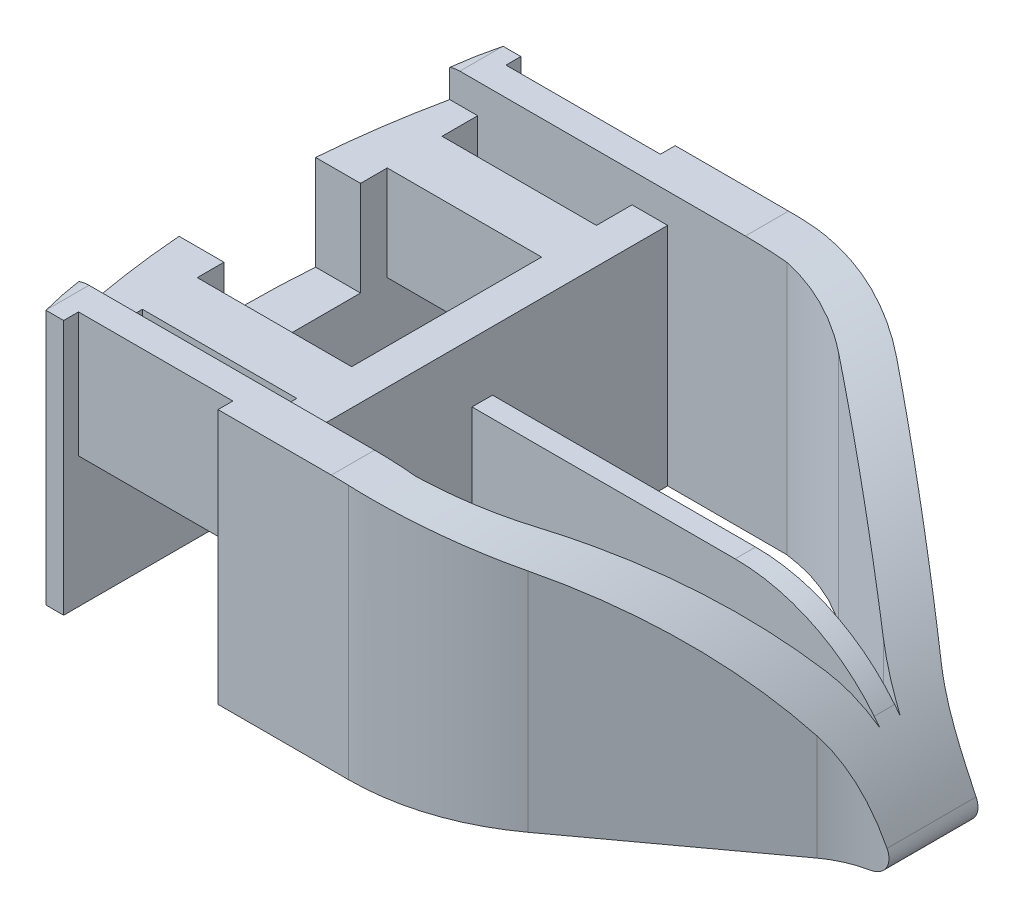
SolidWorks part; units mm, degrees
ref_plane "Plan de face" through (0, 0, 0) normal (0, 0, 1) x (1, 0, 0)
ref_plane "Plan de dessus" through (0, 0, 0) normal (0, 1, 0) x (1, 0, 0)
ref_plane "Plan de droite" through (0, 0, 0) normal (1, 0, 0) x (0, 0, -1)
sketch "Esquisse1" plane through (0, 0, 0) normal (0, 0, 1) x (1, 0, 0)
  line L0 (34, 0) -> (113, 0)
  line L8 (34, 22) -> (8, 22)
  line L9 (53.0917, 43) -> (5, 43)
  line L10 (0, 0) -> (0, 38)
  line L11 (8, 0) -> (8, 22)
  line L12 (8, 0) -> (0, 0)
  line L16 (34, 0) -> (34, 22)
  arc A0 (5, 43) -> (0, 38) centre (5, 38) ccw
  arc A1 (115.6825, 4.3433) -> (53.0917, 43) centre (53.0917, -27) ccw
  arc A2 (113, 0) -> (115.6825, 4.3433) centre (113, 3) ccw
  dimension "D4" = 3
  dimension "D5" = 70
  dimension "D7" = 5
  dimension "D1" = 116
  dimension "D2" = 8
  dimension "D3" = 26
  dimension "D6" = 43
  dimension "D8" = 22
extrude "Extrusion1" add sketch "Esquisse1" along normal mid plane 77
sketch "Esquisse2" plane through (0, 43, 0) normal (0, 1, 0) x (-1, 0, 0)
  line L1 (-5.025, -38.5) -> (0, -38.5)
  line L3 (0, -38.5) -> (0, 0)
  arc A0 (-5.025, -38.5) -> (0, 0) centre (-150, 0) ccw
  dimension "D1" = 150
extrude "Enlèv. mat.-Extru.1" cut sketch "Esquisse2" against normal through all
sketch "Esquisse3" plane through (0, 43, 0) normal (0, 1, 0) x (-1, 0, 0)
  line L0 (-115.6825, 38.5) -> (-115.6825, -38.5) construction
  line L1 (-115.6825, -38.5) -> (-53.0917, -38.5) construction
  line L2 (-116, 38.5) -> (-116, -38.5) construction
  line L3 (-53.0917, 38.5) -> (-115.6825, 38.5) construction
  line L4 (-78.7415, -31.0656) -> (-106.8443, -10.4931)
  line L5 (-56, -38.5) -> (-116, -38.5)
  line L6 (-116, -7.5) -> (-116, -38.5)
  line L7 (-116, 38.5) -> (-116, -38.5) construction
  arc A0 (-106.8443, -10.4931) -> (-116, -7.5) centre (-116, -23) ccw
  arc A1 (-78.7415, -31.0656) -> (-56, -38.5) centre (-56, 0) ccw
  point P4 (-115.6825, 0)
  dimension "D1" = 7.5
  dimension "D2" = 60
extrude "Enlèv. mat.-Extru.2" cut sketch "Esquisse3" against normal through all
mirror "Symétrie1" about plane through (0, 0, 0) normal (0, 0, 1) of "Enlèv. mat.-Extru.2", "Enlèv. mat.-Extru.1"
sketch "Esquisse4" plane through (0, 43, 0) normal (0, 1, 0) x (-1, 0, 0)
  line L6 (-108.6825, -1.7232) -> (-40, -1.7232)
  line L7 (-108.6825, 1.7232) -> (-40, 1.7232)
  line L8 (-40, -31.2331) -> (-40, -1.7232)
  line L9 (-8, -25.2331) -> (-8, -16) construction
  line L10 (-34, -31.2331) -> (-8, -31.2331)
  line L11 (-34, -31.2331) -> (-34, -25.2331)
  line L12 (-108.6825, 1.7232) -> (-108.6825, -1.7232)
  line L13 (-102.7095, -4.8448) -> (-74.6067, -25.4173)
  line L14 (-60.0917, -31.2331) -> (-60.0917, 31.2331)
  line L15 (-74.6067, 25.4173) -> (-102.7095, 4.8448)
  line L16 (-34, -25.2331) -> (-8, -25.2331)
  line L17 (-102.7095, -4.8448) -> (-74.6067, -25.4173)
  line L18 (-60.0917, 31.2331) -> (-40, 31.2331)
  line L19 (-74.6067, 25.4173) -> (-102.7095, 4.8448)
  line L20 (-8, -31.2331) -> (-8, -25.2331)
  line L21 (-8, -16) -> (-34, -16)
  line L22 (-8, -16) -> (-8, 16)
  line L23 (-8, 16) -> (-34, 16)
  line L24 (-34, -16) -> (-34, 16)
  line L25 (-34, 25.2331) -> (-8, 25.2331)
  line L26 (-34, 25.2331) -> (-34, 31.2331)
  line L27 (-34, 31.2331) -> (-8, 31.2331)
  line L28 (-8, 25.2331) -> (-8, 31.2331)
  line L29 (-8, 16) -> (-8, 25.2331) construction
  line L30 (-34, 38.5) -> (-34, -38.5) construction
  line L31 (-60.0917, -31.2331) -> (-40, -31.2331)
  line L32 (-40, 1.7232) -> (-40, 31.2331)
  line L33 (-8, 38.5) -> (-8, -38.5) construction
  arc A8 (-108.6825, 1.7232) -> (-102.7095, 4.8448) centre (-116, 23) ccw
  arc A9 (-102.7095, -4.8448) -> (-108.6825, -1.7232) centre (-116, -23) ccw
  arc A10 (-74.6067, -25.4173) -> (-60.0917, -31.2331) centre (-56, 0) ccw
  arc A11 (-60.0917, 31.2331) -> (-74.6067, 25.4173) centre (-56, 0) ccw
  arc A12 (-108.6825, 1.7232) -> (-102.7095, 4.8448) centre (-116, 23) ccw
  arc A13 (-102.7095, -4.8448) -> (-108.6825, -1.7232) centre (-116, -23) ccw
  arc A14 (-74.6067, -25.4173) -> (-60.0917, -31.2331) centre (-56, 0) ccw
  arc A15 (-60.0917, 31.2331) -> (-74.6067, 25.4173) centre (-56, 0) ccw
  dimension "D2" = 6
  dimension "D3" = 32
  dimension "D4" = 6
  dimension "D1" = 7
extrude "Enlèv. mat.-Extru.3" cut sketch "Esquisse4" against normal through all
sketch "Esquisse5" plane through (0, 0, 0) normal (1, 0, 0) x (0, 0, -1)
  line L0 (0, 23.65) -> (0, -23.65) construction
  line L1 (11.5, 22) -> (-11.5, 22)
  line L2 (11.5, 22) -> (11.5, 38)
  line L3 (11.5, 38) -> (31.2331, 38)
  line L4 (-11.5, 22) -> (-11.5, 38)
  line L6 (-31.2331, 43) -> (31.2331, 43)
  line L7 (-31.2331, 43) -> (-31.2331, 38)
  line L8 (-31.2331, 38) -> (-11.5, 38)
  line L9 (31.2331, 43) -> (31.2331, 38)
  line L10 (-38.4057, 43) -> (38.4057, 43) construction
  line L11 (31.2331, 22) -> (31.2331, 43) construction
  line L12 (-31.2331, 22) -> (-31.2331, 43) construction
  line L13 (-38.5, 0) -> (38.5, 0) construction
  point P4 (0, 22)
  dimension "D1" = 23
  dimension "D2" = 38
  dimension "D3" = 22
extrude "Enlèv. mat.-Extru.4" cut sketch "Esquisse5" along normal up to surface (34 mm away)
sketch "Esquisse6" plane through (34, 0, 0) normal (-1, 0, 0) x (0, 0, 1)
  line L0 (-16, 38) -> (-25.2331, 38) construction
  line L1 (-31.2331, 38) -> (31.2331, 38)
  line L2 (-31.2331, 38) -> (-31.2331, 43)
  line L3 (-31.2331, 43) -> (31.2331, 43)
  line L4 (31.2331, 38) -> (31.2331, 43)
extrude "Enlèv. mat.-Extru.5" cut sketch "Esquisse6" against normal up to next
sketch "Esquisse7" plane through (40, 0, 0) normal (1, 0, 0) x (0, 0, -1)
  line L1 (1.7232, 38) -> (-1.7232, 38)
  line L2 (1.7232, 38) -> (1.7232, 28)
  line L3 (1.7232, 28) -> (-1.7232, 28)
  line L4 (-1.7232, 38) -> (-1.7232, 28)
  dimension "D1" = 10
extrude "Enlèv. mat.-Extru.6" cut sketch "Esquisse7" along normal through all
fillet "Congé1" radius 30 1 edges at (96.393, 28, 0)
sketch "Esquisse8" plane through (0, 43, 0) normal (0, 1, 0) x (-1, 0, 0)
  line L0 (-53.0917, -38.5) -> (-5.025, -38.5) construction
  line L1 (-8, -38.5) -> (-34, -38.5)
  line L2 (-8, -38.5) -> (-8, -36)
  line L3 (-8, -36) -> (-34, -36)
  line L4 (-34, -38.5) -> (-34, -36)
  line L5 (-53.0917, 38.5) -> (-5.025, 38.5) construction
  line L6 (-8, 38.5) -> (-34, 38.5)
  line L7 (-8, 38.5) -> (-8, 36)
  line L8 (-8, 36) -> (-34, 36)
  line L9 (-34, 38.5) -> (-34, 36)
  line L10 (-8, -25.2331) -> (-8, -31.2331) construction
  line L11 (-34, -31.2331) -> (-34, -25.2331) construction
  dimension "D1" = 72
extrude "Enlèv. mat.-Extru.7" cut sketch "Esquisse8" against normal through all
